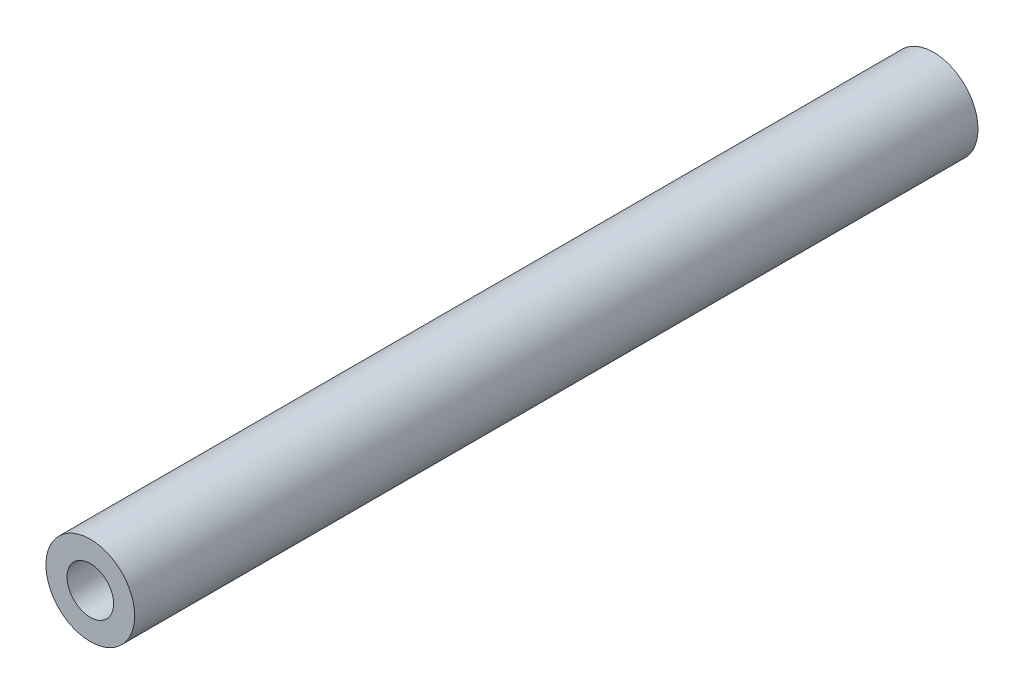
SolidWorks part; units mm, degrees
ref_plane "Face" through (0, 0, 0) normal (0, 0, 1) x (1, 0, 0)
ref_plane "Dessus" through (0, 0, 0) normal (0, 1, 0) x (1, 0, 0)
ref_plane "Droite" through (0, 0, 0) normal (1, 0, 0) x (0, 0, -1)
sketch "Esquisse1" plane through (0, 0, 0) normal (0, 0, 1) x (1, 0, 0)
  circle A0 centre (0, 0) radius 4
  dimension "D1" = 8
extrude "Extrusion1" add sketch "Esquisse1" along normal blind 38
hole_wizard "Trou taraudé M51" positions "Esquisse3" profile "Esquisse2" tap size "M5" standard "ISO"
sketch "Esquisse3" plane through (0, 0, 38) normal (0, 0, 1) x (1, 0, 0)
  point P0 (0, 0)
sketch "Esquisse2" plane through (0, 0, 38) normal (1, 0, 0) x (0, -1, 0)
  line L0 (0, 0) -> (0, 15.6618)
  line L1 (0, 15.6618) -> (2.1, 14.4)
  line L2 (2.1, 14.4) -> (2.1, 0)
  line L5 (2.1, 0) -> (0, 0)
  line L10 (0, 15.6618) -> (-2.1, 14.4) construction
  line L11 (0, -6.35) -> (0, 107.95) construction
  dimension "Diamètre du trou pour taraudage" = 4.2
  dimension "Profondeur du trou pour taraudage" = 14.4
  dimension "Angle de pointe" = 118
mirror "Symétrie1" about plane through (0, 0, 0) normal (0, 0, 1)
